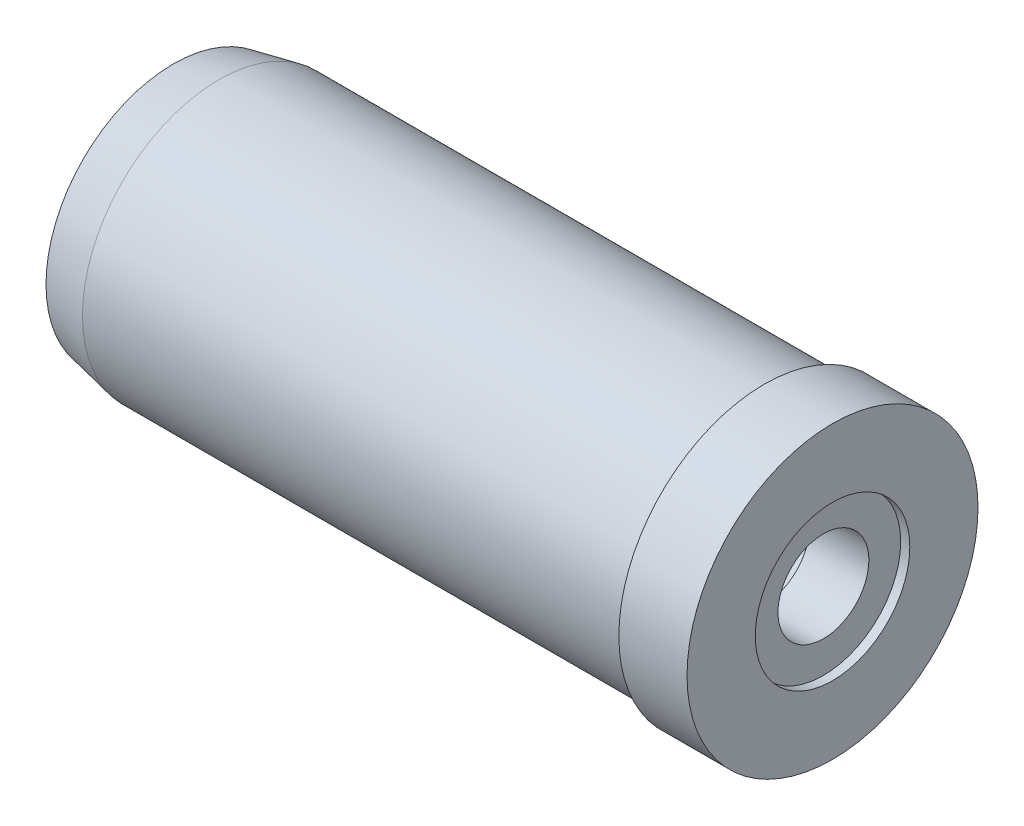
SolidWorks part; units mm, degrees
ref_plane "Plan de face" through (0, 0, 0) normal (0, 0, 1) x (1, 0, 0)
ref_plane "Plan de dessus" through (0, 0, 0) normal (0, 1, 0) x (1, 0, 0)
ref_plane "Plan de droite" through (0, 0, 0) normal (1, 0, 0) x (0, 0, -1)
sketch "Esquisse1" plane through (0, 0, 0) normal (0, 0, 1) x (1, 0, 0)
  line L0 (175.5498, 10) -> (175.5498, 17)
  line L1 (175.5498, 17) -> (177.5498, 17)
  line L2 (177.5498, 17) -> (177.5498, 32)
  line L3 (177.5498, 32) -> (162.5498, 32)
  line L4 (162.5498, 32) -> (162.5498, 30)
  line L5 (162.5498, 30) -> (42.5664, 30)
  line L6 (42.5664, 30) -> (32.5498, 28)
  line L7 (32.5498, 28) -> (32.5498, 24)
  line L8 (32.5498, 24) -> (162.5498, 24)
  line L9 (162.5498, 24) -> (162.5498, 10)
  line L10 (162.5498, 10) -> (175.5498, 10)
  line L11 (32.5498, 0) -> (177.5498, 0) construction
revolve "Révolution1" add sketch "Esquisse1" angle 360 about L11
